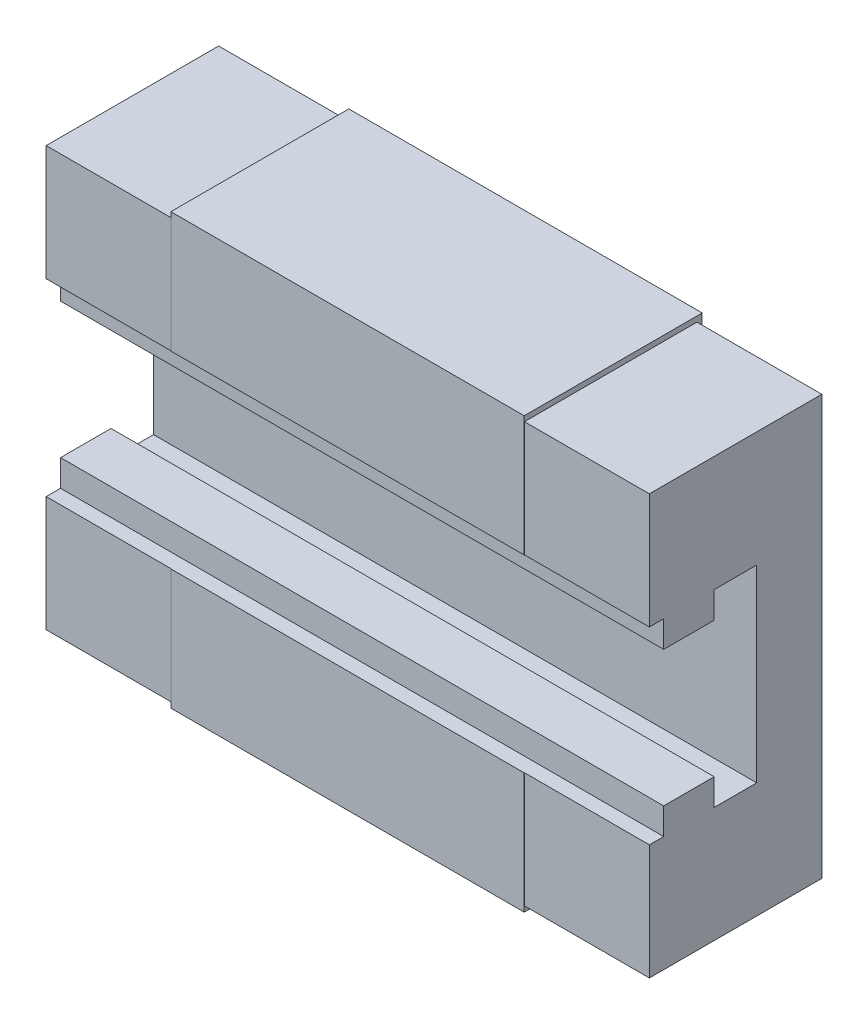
SolidWorks part; units mm, degrees
ref_plane "前视基准面" through (0, 0, 0) normal (0, 0, 1) x (1, 0, 0)
ref_plane "上视基准面" through (0, 0, 0) normal (0, 1, 0) x (1, 0, 0)
ref_plane "右视基准面" through (0, 0, 0) normal (1, 0, 0) x (0, 0, -1)
sketch "草图1" plane through (0, 0, 0) normal (0, 0, 1) x (1, 0, 0)
  line L1 (0, 0) -> (13.3, 0)
  line L2 (0, 0) -> (0, 16.18)
  line L3 (0, 16.18) -> (13.3, 16.18)
  line L4 (13.3, 0) -> (13.3, 16.18)
  dimension "D1" = 13.3
  dimension "D2" = 16.18
extrude "凸台-拉伸1" add sketch "草图1" along normal blind 6.7
sketch "草图2" plane through (13.3, 0, 0) normal (1, 0, 0) x (0, 0, -1)
  line L0 (-0.2, 15.98) -> (-6.5, 15.98)
  line L2 (-6.5, 0.2) -> (-0.2, 0.2)
  line L3 (-0.2, 0.2) -> (-0.2, 15.98)
  line L4 (0, 0) -> (0, 16.18)
  line L5 (0, 16.18) -> (-6.7, 16.18)
  line L6 (-6.7, 16.18) -> (-6.7, 0)
  line L7 (-6.7, 0) -> (0, 0)
  line L8 (0, 0) -> (0, 16.18)
  line L9 (0, 16.18) -> (-6.7, 16.18)
  line L10 (-6.7, 16.18) -> (-6.7, 0)
  line L11 (-6.7, 0) -> (0, 0)
  line L13 (-6.5, 15.98) -> (-6.7, 15.98)
  line L15 (-6.5, 0.2) -> (-6.7, 0.2)
  line L16 (-6.7, 15.98) -> (-6.7, 0.2)
  line L17 (-6.5, 15.98) -> (-6.5, 0.2) construction
  dimension "D1" = 0
  dimension "D2" = 0.2
extrude "凸台-拉伸2" add sketch "草图2" along normal blind 4.7 contours L17 L13 L10 L15 | L0 L17 L2 L3
sketch "草图3" plane through (0, 0, 0) normal (-1, 0, 0) x (0, 0, 1)
  line L4 (0, 16.18) -> (0, 0)
  line L5 (6.7, 16.18) -> (0, 16.18)
  line L6 (6.7, 0) -> (6.7, 16.18)
  line L7 (0, 0) -> (6.7, 0)
  line L8 (0, 16.18) -> (0, 0)
  line L9 (6.7, 16.18) -> (0, 16.18)
  line L10 (6.7, 0) -> (6.7, 16.18)
  line L11 (0, 0) -> (6.7, 0)
  line L14 (6.5, 15.98) -> (0.2, 15.98)
  line L15 (6.7, 15.98) -> (6.5, 15.98)
  line L16 (6.7, 15.98) -> (6.5, 15.98)
  line L17 (6.7, 0.2) -> (6.7, 15.98)
  line L18 (0.2, 0.2) -> (6.5, 0.2)
  line L19 (0.2, 15.98) -> (0.2, 0.2)
  line L20 (6.5, 15.98) -> (0.2, 15.98)
  line L24 (0.2, 0.2) -> (6.5, 0.2)
  line L25 (0.2, 15.98) -> (0.2, 0.2)
  line L26 (6.7, 0.2) -> (6.7, 15.98)
  line L27 (6.5, 0.2) -> (6.7, 0.2)
  line L28 (6.5, 0.2) -> (6.7, 0.2)
  dimension "D1" = 0
  dimension "D2" = 0
extrude "凸台-拉伸3" add sketch "草图3" along normal blind 4.7 contours L20 L25 L24 L28 L10 L16
sketch "草图4" plane through (18, 0, 0) normal (1, 0, 0) x (0, 0, -1)
  line L0 (-2.65, 11.64) -> (-4.25, 11.64)
  line L1 (-4.25, 11.64) -> (-4.25, 10.64)
  line L2 (-4.25, 10.64) -> (-6.15, 10.64)
  line L3 (-6.15, 10.64) -> (-6.15, 11.64)
  line L4 (-6.15, 11.64) -> (-7.75, 11.64)
  line L5 (-7.75, 11.64) -> (-7.75, 4.54)
  line L6 (-7.75, 4.54) -> (-6.15, 4.54)
  line L7 (-6.15, 4.54) -> (-6.15, 5.54)
  line L8 (-6.15, 5.54) -> (-4.25, 5.54)
  line L9 (-4.25, 5.54) -> (-4.25, 4.54)
  line L10 (-4.25, 4.54) -> (-2.65, 4.54)
  line L11 (-2.65, 4.54) -> (-2.65, 11.64)
  line L12 (-2.7, 11.59) -> (-4.2, 11.59)
  line L13 (-4.2, 11.59) -> (-4.2, 10.59)
  line L14 (-4.2, 10.59) -> (-6.2, 10.59)
  line L15 (-6.2, 10.59) -> (-6.2, 11.59)
  line L16 (-6.2, 11.59) -> (-7.7, 11.59)
  line L17 (-7.7, 11.59) -> (-7.7, 4.59)
  line L18 (-7.7, 4.59) -> (-6.2, 4.59)
  line L19 (-6.2, 4.59) -> (-6.2, 5.59)
  line L20 (-6.2, 5.59) -> (-4.2, 5.59)
  line L21 (-4.2, 5.59) -> (-4.2, 4.59)
  line L22 (-4.2, 4.59) -> (-2.7, 4.59)
  line L23 (-2.7, 4.59) -> (-2.7, 11.59)
  line L26 (-4.2, 10.59) -> (-6.2, 10.59)
  line L27 (-6.2, 10.59) -> (-6.2, 11.59)
  line L28 (-6.2, 11.59) -> (-7.7, 11.59)
  line L29 (-7.7, 11.59) -> (-7.7, 4.59)
  line L30 (-7.7, 4.59) -> (-6.2, 4.59)
  line L31 (-6.2, 4.59) -> (-6.2, 5.59)
  line L32 (-6.2, 5.59) -> (-4.2, 5.59)
  line L33 (-4.2, 5.59) -> (-4.2, 4.59)
  line L34 (-4.2, 4.59) -> (-2.7, 4.59)
  line L35 (-2.7, 4.59) -> (-2.7, 11.59)
  line L36 (-2.7, 11.59) -> (-4.2, 11.59) construction
  line L37 (-4.2, 11.59) -> (-4.2, 10.59) construction
  dimension "D1" = 0
  dimension "D2" = 0.05
extrude "切除-拉伸2" cut sketch "草图4" against normal through all contours L0 L1 L2 L3 L4 L5 L6 L7 L8 L9 L10 L11
sketch "草图5" plane through (0, 0, 0) normal (0, 0, -1) x (-1, 0, 0)
  line L4 (0, 0) -> (0, 16.18)
  line L5 (0, 16.18) -> (-13.3, 16.18)
  line L6 (-13.3, 16.18) -> (-13.3, 0)
  line L7 (-13.3, 0) -> (0, 0)
  line L9 (0, 16.18) -> (-13.3, 16.18)
  line L10 (-13.3, 16.18) -> (-13.3, 0)
  line L11 (-13.3, 0) -> (0, 0)
  line L13 (0, 0) -> (0, 16.18)
  circle A0 centre (-10.65, 14.09) radius 1.05
  circle A1 centre (-2.65, 14.09) radius 1.05
  circle A2 centre (-10.65, 2.09) radius 1.05
  circle A3 centre (-2.65, 2.09) radius 1.05
  dimension "D2" = 2.1
  dimension "D3" = 8
  dimension "D4" = 12
  dimension "D5" = 2.09
  dimension "D6" = 2.65
  dimension "D1" = 0
extrude "切除-拉伸3" cut sketch "草图5" against normal blind 5 contours A0 | A1 | A2 | A3
sketch "草图6" plane through (0, 0, 6.7) normal (0, 0, 1) x (1, 0, 0)
  line L0 (0, 15.98) -> (0, 11.64)
  line L1 (0, 4.54) -> (0, 0.2)
  line L2 (13.3, 15.98) -> (13.3, 11.64)
  line L3 (13.3, 11.64) -> (18, 11.64)
  line L4 (0, 4.54) -> (-4.7, 4.54)
  line L5 (13.3, 4.54) -> (13.3, 0.2)
  line L8 (-4.7, 15.98) -> (-4.7, 11.64)
  line L9 (-4.7, 11.64) -> (18, 11.64)
  line L10 (18, 11.64) -> (18, 15.98)
  line L11 (18, 15.98) -> (13.3, 15.98)
  line L12 (13.3, 15.98) -> (13.3, 16.18)
  line L13 (13.3, 16.18) -> (0, 16.18)
  line L14 (0, 16.18) -> (0, 15.98)
  line L15 (0, 15.98) -> (-4.7, 15.98)
  line L16 (-4.7, 15.98) -> (-4.7, 11.64)
  line L17 (-4.7, 11.64) -> (0, 11.64)
  line L18 (18, 11.64) -> (18, 15.98)
  line L19 (18, 15.98) -> (13.3, 15.98)
  line L20 (13.3, 15.98) -> (13.3, 16.18)
  line L22 (0, 16.18) -> (0, 15.98)
  line L23 (0, 15.98) -> (-4.7, 15.98)
  line L24 (18, 0.2) -> (18, 4.54)
  line L25 (18, 4.54) -> (-4.7, 4.54)
  line L26 (-4.7, 4.54) -> (-4.7, 0.2)
  line L27 (-4.7, 0.2) -> (0, 0.2)
  line L28 (0, 0.2) -> (0, 0)
  line L29 (0, 0) -> (13.3, 0)
  line L30 (13.3, 0) -> (13.3, 0.2)
  line L31 (13.3, 0.2) -> (18, 0.2)
  line L32 (18, 0.2) -> (18, 4.54)
  line L33 (18, 4.54) -> (13.3, 4.54)
  line L34 (-4.7, 4.54) -> (-4.7, 0.2)
  line L35 (-4.7, 0.2) -> (0, 0.2)
  line L36 (0, 0.2) -> (0, 0)
  line L38 (13.3, 0) -> (13.3, 0.2)
  line L39 (13.3, 0.2) -> (18, 0.2)
  dimension "D1" = 0
  dimension "D2" = 0
extrude "切除-拉伸4" cut sketch "草图6" against normal blind 0.01 contours L23 L16 L17 L0 | L1 L4 L34 L35 | L39 L32 L33 L5 | L2 L3 L18 L19
